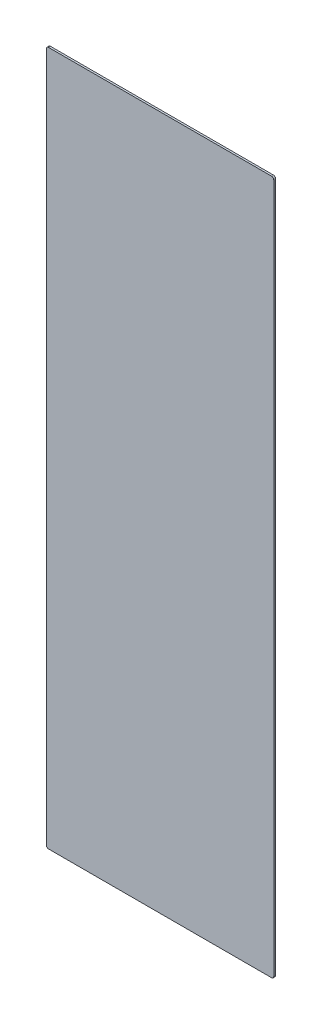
SolidWorks part; units mm, degrees
ref_plane "Front Plane" through (0, 0, 0) normal (0, 0, 1) x (1, 0, 0)
ref_plane "Top Plane" through (0, 0, 0) normal (0, 1, 0) x (1, 0, 0)
ref_plane "Right Plane" through (0, 0, 0) normal (1, 0, 0) x (0, 0, -1)
sketch "Sketch1" plane through (0, 0, 0) normal (1, 0, 0) x (0, 0, -1)
  line L1 (-2, 763) -> (2, 763)
  line L2 (-2, 763) -> (-2, -763)
  line L3 (-2, -763) -> (2, -763)
  line L4 (2, 763) -> (2, -763)
  line L5 (-2, 763) -> (2, -763) construction
  line L6 (-2, -763) -> (2, 763) construction
  point P0 (0, 0)
  dimension "D1" = 4
  dimension "D2" = 1526
extrude "Boss-Extrude1" add sketch "Sketch1" along normal mid plane 500
fillet "Fillet1" radius 5 4 edges at (250, -763, 0) (-250, -763, 0) (-250, 763, 0) (250, 763, 0)
sketch "Sketch2" plane through (0, 0, -2) normal (0, 0, -1) x (-1, 0, 0)
  line L4 (-250, 758) -> (-250, -758)
  line L5 (-245, -763) -> (245, -763)
  line L6 (250, -758) -> (250, 758)
  line L7 (245, 763) -> (-245, 763)
  line L8 (-250, 758) -> (-250, -758)
  line L9 (-245, -763) -> (245, -763)
  line L10 (250, -758) -> (250, 758)
  line L11 (245, 763) -> (-245, 763)
  arc A4 (-250, -758) -> (-245, -763) centre (-245, -758) ccw
  arc A5 (245, -763) -> (250, -758) centre (245, -758) ccw
  arc A6 (250, 758) -> (245, 763) centre (245, 758) ccw
  arc A7 (-245, 763) -> (-250, 758) centre (-245, 758) ccw
  arc A8 (-250, -758) -> (-245, -763) centre (-245, -758) ccw
  arc A9 (245, -763) -> (250, -758) centre (245, -758) ccw
  arc A10 (250, 758) -> (245, 763) centre (245, 758) ccw
  arc A11 (-245, 763) -> (-250, 758) centre (-245, 758) ccw
  dimension "D1" = 0
extrude "Boss-Extrude2" add sketch "Sketch2" along normal blind 0.25
sketch "Sketch3" plane through (0, 0, -2.25) normal (0, 0, -1) x (-1, 0, 0)
  line L1 (-185, 722.5) -> (185, 722.5)
  line L2 (-210, 697.5) -> (-210, -697.5)
  line L3 (-185, -722.5) -> (185, -722.5)
  line L4 (210, 697.5) -> (210, -697.5)
  line L5 (-210, 722.5) -> (210, -722.5) construction
  line L6 (-210, -722.5) -> (210, 722.5) construction
  arc A0 (185, -722.5) -> (210, -697.5) centre (185, -697.5) ccw
  arc A1 (-210, -697.5) -> (-185, -722.5) centre (-185, -697.5) ccw
  arc A2 (185, 722.5) -> (210, 697.5) centre (185, 697.5) cw
  arc A3 (-185, 722.5) -> (-210, 697.5) centre (-185, 697.5) ccw
  point P0 (0, 0)
  dimension "D1" = 25
  dimension "D2" = 420
  dimension "D3" = 1445
extrude "Cut-Extrude1" cut sketch "Sketch3" against normal blind 0.25
